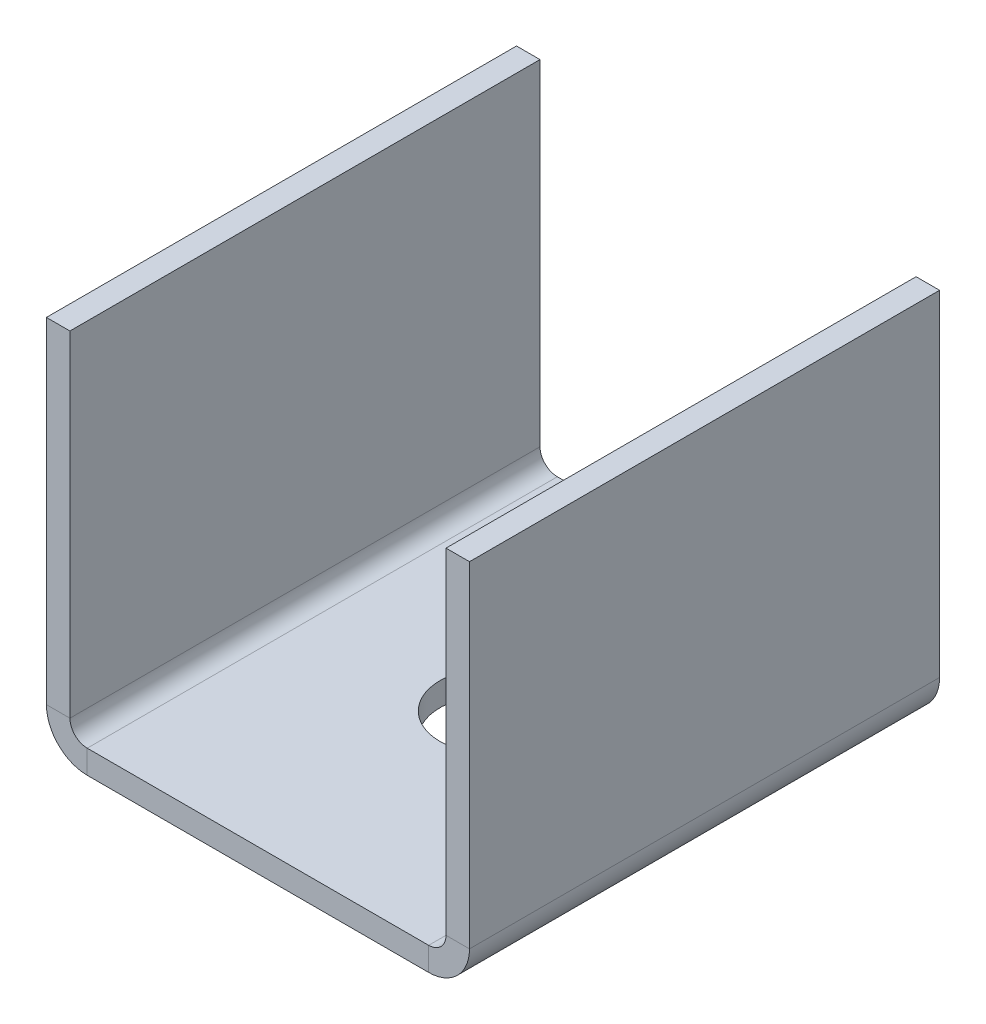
SolidWorks part; units mm, degrees
ref_plane "Front" through (0, 0, 0) normal (0, 0, 1) x (1, 0, 0)
ref_plane "Top" through (0, 0, 0) normal (0, 1, 0) x (1, 0, 0)
ref_plane "Right" through (0, 0, 0) normal (1, 0, 0) x (0, 0, -1)
sketch "Sketch1" plane through (0, 0, 0) normal (0, 1, 0) x (1, 0, 0)
  line L1 (0, 0) -> (50, 0)
  line L2 (0, 0) -> (0, 20)
  line L3 (0, 20) -> (50, 20)
  line L4 (50, 0) -> (50, 20)
  circle A0 centre (25, 10) radius 2.25
sheet metal parameters "Sheet-Metal1" thickness 1 parameters "D1"=0.7366
base flange "Base-Flange1" sketch "Sketch1" thickness 1 reverse thickness direction yes parameters "D1"=0.7366
sketch "Sketch3" plane through (0, 1, 0) normal (0, 1, 0) x (-1, 0, 0)
  line L2 (-16, 0) -> (-16, -20)
  line L3 (-34, 0) -> (-34, -20)
sketched bend "Sketched Bend2" parameters "D1"=0
bend "SketchBend3" bend radius 0.7366 bend angle 90 parameters "D5"=1
bend "SketchBend4" bend radius 0 bend angle 90 parameters "D5"=2
sketch "Sketch4" plane through (0, 18.4732, 0) normal (0, 1, 0) x (-1, 0, 0)
  line L0 (-16, 0) -> (-16, -20)
  line L1 (-16, -20) -> (-17, -20)
  line L2 (-17, -20) -> (-17, 0)
  line L3 (-17, 0) -> (-16, 0)
  line L4 (-33, 0) -> (-34, 0)
  line L5 (-34, 0) -> (-34, -20)
  line L6 (-34, -20) -> (-33, -20)
  line L7 (-33, -20) -> (-33, 0)
extrude "Cut-Extrude1" cut sketch "Sketch4" against normal blind 2.47
flat pattern "Flat-Pattern1"
sketch "Bend-Lines1" plane through (0, 1, 0) normal (0, 1, 0) x (-1, 0, 0)
  line L0 (-32.7634, 0) -> (-32.7634, -20) construction
  line L1 (-17.2366, 0) -> (-17.2366, -20) construction
bend of the flat pattern "Flatten-<SketchBend3>1"
bend of the flat pattern "Flatten-<SketchBend4>1"
